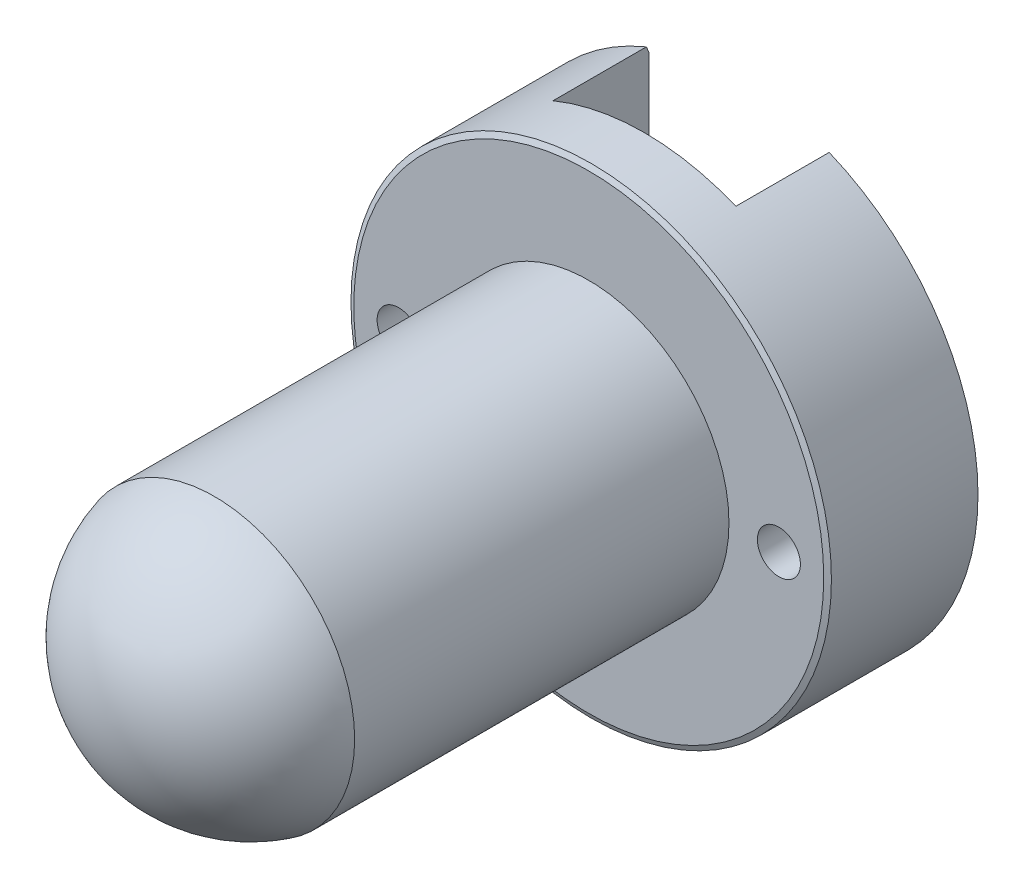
SolidWorks part; units mm, degrees
ref_plane "Plane1" through (0, 0, 0) normal (0, 0, 1) x (1, 0, 0)
ref_plane "Plane2" through (0, 0, 0) normal (0, 1, 0) x (1, 0, 0)
ref_plane "Plane3" through (0, 0, 0) normal (1, 0, 0) x (0, 0, -1)
sketch "Sketch1" plane through (0, 0, 0) normal (0, 0, 1) x (1, 0, 0)
  circle A0 centre (0, 0) radius 37.465
  dimension "D1" = 74.93
extrude "Base-Extrude" add sketch "Sketch1" along normal blind 23.622
chamfer "Chamfer1" distance 0.381 angle 65
chamfer "Chamfer2" distance 0.381 angle 65
sketch "Sketch2" plane through (0, 0, 23.622) normal (0, 0, 1) x (1, 0, 0)
  circle A0 centre (0, 0) radius 21.8694
  dimension "D1" = 43.7388
sketch "Sketch3" plane through (0, 0, 0) normal (0, 1, 0) x (1, 0, 0)
  line L0 (0, 0) -> (0, -106.0199) construction
  line L1 (0, -23.241) -> (0, -0.381) construction
  line L3 (-21.8694, -23.622) -> (-21.8694, -82.0003)
  line L5 (-20.5994, -24.892) -> (-20.5994, -81.8359)
  line L6 (0, -23.622) -> (0, -24.892)
  line L7 (-21.8694, -23.622) -> (21.8694, -23.622)
  line L8 (-21.8694, -23.622) -> (0, -23.622)
  line L9 (-20.5994, -24.892) -> (0, -24.892)
  line L10 (0, -97.6503) -> (0, -98.9203)
  arc A0 (-21.8694, -82.0003) -> (0, -98.9203) centre (0, -76.327) ccw
  arc A1 (-20.5994, -81.8359) -> (0, -97.6503) centre (0, -76.327) ccw
  dimension "D1" = 45.1866
  dimension "D3" = 1.27
  dimension "D2" = 0
revolve "Bulb" add sketch "Sketch3" angle 360 about L0
sketch "Sketch9" plane through (0, 0, 0) normal (0, 1, 0) x (1, 0, 0)
  line L0 (0, 0) -> (0, 68.6117) construction
  line L1 (0, -23.241) -> (0, -0.381) construction
  line L2 (0, 0) -> (12.446, 0)
  line L3 (36.6479, 0) -> (-36.6479, 0) construction
  line L4 (12.446, 0) -> (12.446, 18.415)
  line L5 (12.446, 18.415) -> (7.874, 49.53)
  line L6 (7.874, 49.53) -> (0, 49.53)
  line L7 (0, 49.53) -> (0, 0)
  dimension "D1" = 12.446
  dimension "D2" = 18.415
  dimension "D3" = 49.53
  dimension "D4" = 7.874
revolve "CableBase" [suppressed] add sketch "Sketch9" angle 360 about L0
sketch "Sketch10" plane through (0, 0, 0) normal (0, 0, -1) x (-1, 0, 0)
  line L0 (0, 0) -> (0, 31.6932) construction
  line L1 (0, 0) -> (-59.309, 0) construction
  circle A0 centre (-29.6545, 0) radius 3.3528
  circle A2 centre (29.6545, 0) radius 3.3528
  dimension "D1" = 6.7056
  dimension "D2" = 29.6545
extrude "MountHoles" cut sketch "Sketch10" against normal through all
sketch "Sketch11" [suppressed] plane through (0, 0, -49.53) normal (0, 0, -1) x (-1, 0, 0)
  circle A0 centre (0, 0) radius 5.9055
  dimension "D1" = 11.811
sketch "Sketch12" [suppressed] plane through (0, 0, 0) normal (1, 0, 0) x (0, 0, -1)
  spline_without_curve S0
sketch "Sketch13" plane through (0, 0, 0) normal (0, 0, -1) x (-1, 0, 0)
  line L0 (0, -16.6541) -> (0, 41.8999) construction
  line L1 (-14.2566, 40.4285) -> (14.2566, 40.4285)
  line L2 (-14.2566, 40.4285) -> (-14.2566, -10.6926)
  line L3 (-11.7166, -13.2326) -> (11.7166, -13.2326)
  line L4 (14.2566, 40.4285) -> (14.2566, -10.6926)
  circle A0 centre (0, 0) radius 37.465 construction
  arc A1 (-11.7166, -13.2326) -> (-14.2566, -10.6926) centre (-11.7166, -10.6926) cw
  arc A2 (11.7166, -13.2326) -> (14.2566, -10.6926) centre (11.7166, -10.6926) ccw
  point P4 (-14.2566, 34.6464)
  dimension "D2" = 2.54
  dimension "D1" = 47.879
extrude "Cut-Extrude1" cut sketch "Sketch13" against normal blind 14.9352
